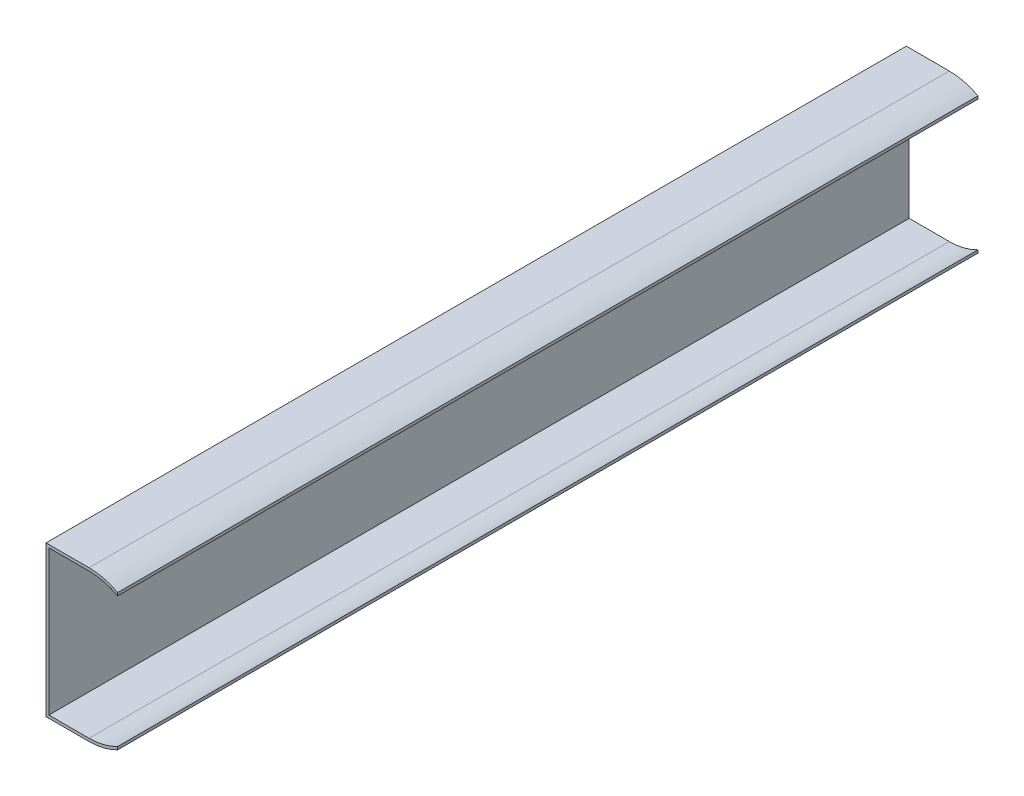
SolidWorks part; units mm, degrees
ref_plane "Plan de face" through (0, 0, 0) normal (0, 0, 1) x (1, 0, 0)
ref_plane "Plan de dessus" through (0, 0, 0) normal (0, 1, 0) x (1, 0, 0)
ref_plane "Plan de droite" through (0, 0, 0) normal (1, 0, 0) x (0, 0, -1)
sketch "Esquisse1" plane through (0, 0, 0) normal (0, 0, 1) x (1, 0, 0)
  line L0 (0, 0) -> (0, 105)
  line L1 (0, 105) -> (30, 105)
  line L2 (0, 52.5) -> (81.0721, 52.5) construction
  line L3 (2, 103) -> (2, 2)
  line L4 (0, 0) -> (30, 0)
  line L5 (2, 103) -> (30, 103)
  line L6 (50, 100) -> (50, 98)
  line L7 (50, 5) -> (50, 7)
  line L8 (2, 2) -> (30, 2)
  spline S0 degree 2 poles (30, 105) (40.6033, 104.9515) (50, 100) knots 0 0 0 1 1 1
  spline S1 degree 2 poles (30, 0) (40.6033, 0.0485) (50, 5) knots 0 0 0 1 1 1
  spline S2 degree 2 poles (30, 103) (40.6033, 102.9515) (50, 98) knots 0 0 0 1 1 1
  spline S3 degree 2 poles (30, 2) (40.6033, 2.0485) (50, 7) knots 0 0 0 1 1 1
  point P20 (2, 52.5)
  dimension "D1" = 105
  dimension "D2" = 30
  dimension "D3" = 5
  dimension "D4" = 50
  dimension "D5" = 1.2
  dimension "D6" = 10
  dimension "D7" = 5
  dimension "D8" = 10
  dimension "D9" = 1.2
  dimension "D10" = 28
  dimension "D11" = 20
  dimension "D12" = 2
  dimension "D13" = 2
extrude "Extrusion1" add sketch "Esquisse1" along normal blind 600
